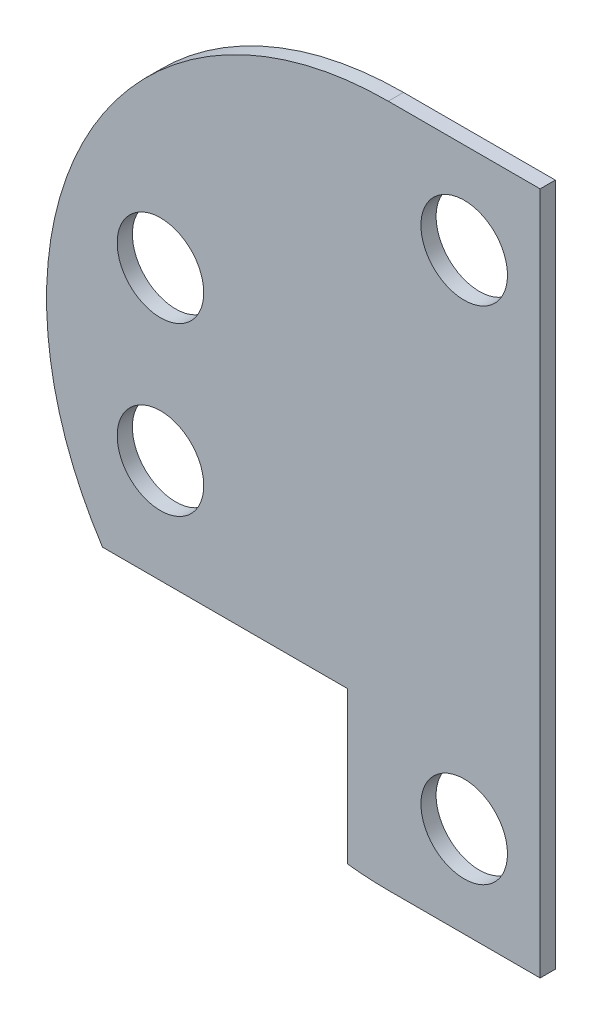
SolidWorks part; units mm, degrees
ref_plane "Front Plane" through (0, 0, 0) normal (0, 0, 1) x (1, 0, 0)
ref_plane "Top Plane" through (0, 0, 0) normal (0, 1, 0) x (1, 0, 0)
ref_plane "Right Plane" through (0, 0, 0) normal (1, 0, 0) x (0, 0, -1)
imported_body "Imported1"
sketch "Sketch1" plane through (0, 0, 0) normal (0, 0, -1) x (-1, 0, 0)
  line L0 (5, -22.5) -> (-5, -22.5) construction
  line L1 (7.7, -12.34) -> (23.8142, -12.34)
  line L2 (7.7, -12.34) -> (7.7, -22.3374)
  line L3 (-5, -22.5) -> (-5, 22.5) construction
  arc A0 (5, -22.5) -> (5, 22.5) centre (5, 0) ccw construction
  arc A1 (7.7, -22.3374) -> (23.8142, -12.34) centre (5, 0) ccw
  dimension "D1" = 10.16
  dimension "D2" = 12.7
extrude "Cut-Extrude1" cut sketch "Sketch1" against normal through all contours L1 A1 L2
